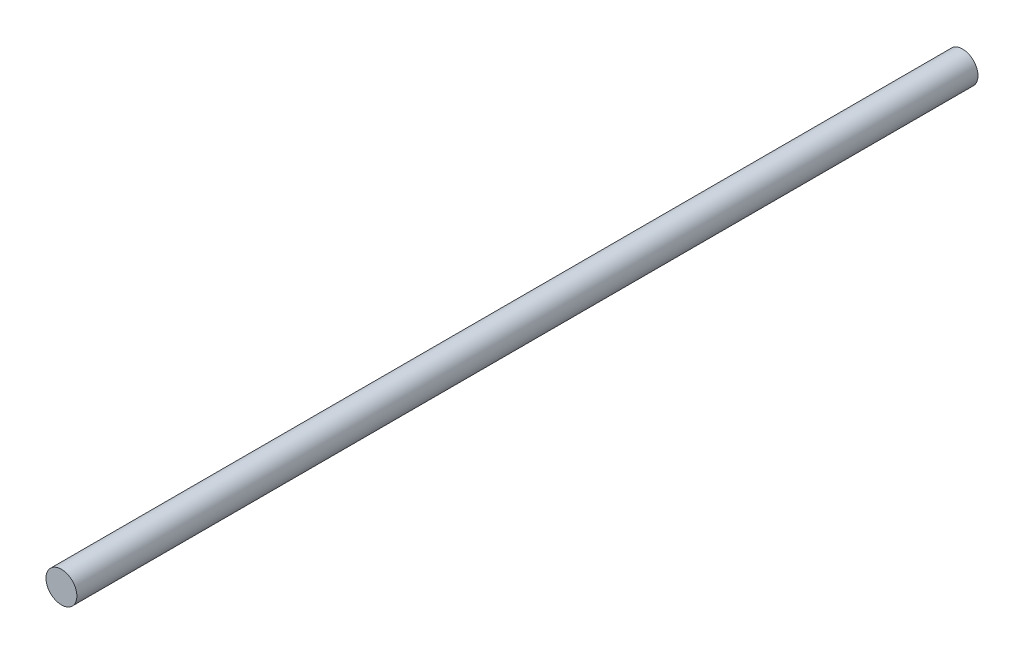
SolidWorks part; units mm, degrees
ref_plane "Front Plane" through (0, 0, 0) normal (0, 0, 1) x (1, 0, 0)
ref_plane "Top Plane" through (0, 0, 0) normal (0, 1, 0) x (1, 0, 0)
ref_plane "Right Plane" through (0, 0, 0) normal (1, 0, 0) x (0, 0, -1)
sketch "Sketch1" plane through (0, 0, 0) normal (0, 0, 1) x (1, 0, 0)
  circle A0 centre (0, 0) radius 30
  dimension "D1" = 60
extrude "Boss-Extrude1" add sketch "Sketch1" against normal blind 1750
